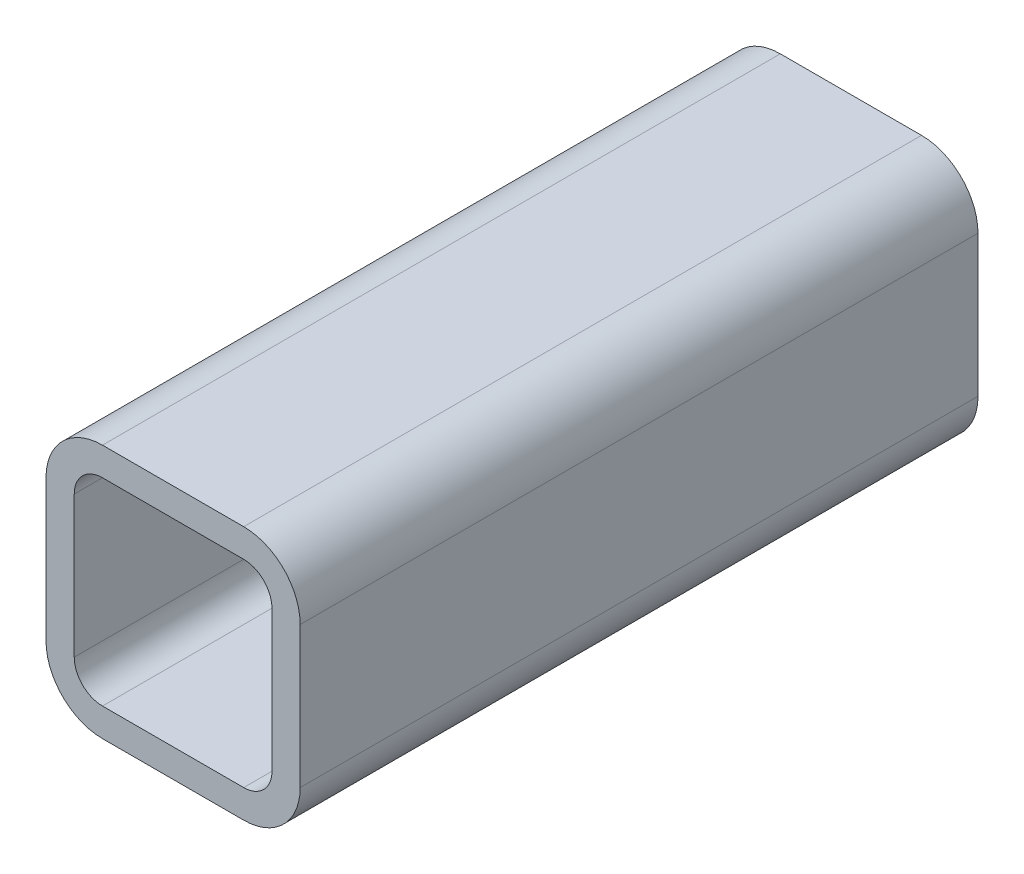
SolidWorks part; units mm, degrees
ref_plane "Front Plane" through (0, 0, 0) normal (0, 0, 1) x (1, 0, 0)
ref_plane "Top Plane" through (0, 0, 0) normal (0, 1, 0) x (1, 0, 0)
ref_plane "Right Plane" through (0, 0, 0) normal (1, 0, 0) x (0, 0, -1)
sketch "Sketch1" plane through (0, 0, 0) normal (0, 0, 1) x (1, 0, 0)
sketch_block_instance "HSS4.5x4.5x0.500-1"
sketch_block "HSS4.5x4.5x0.500"
extrude "Boss-Extrude1" add sketch "Sketch1" along normal blind 304.8
